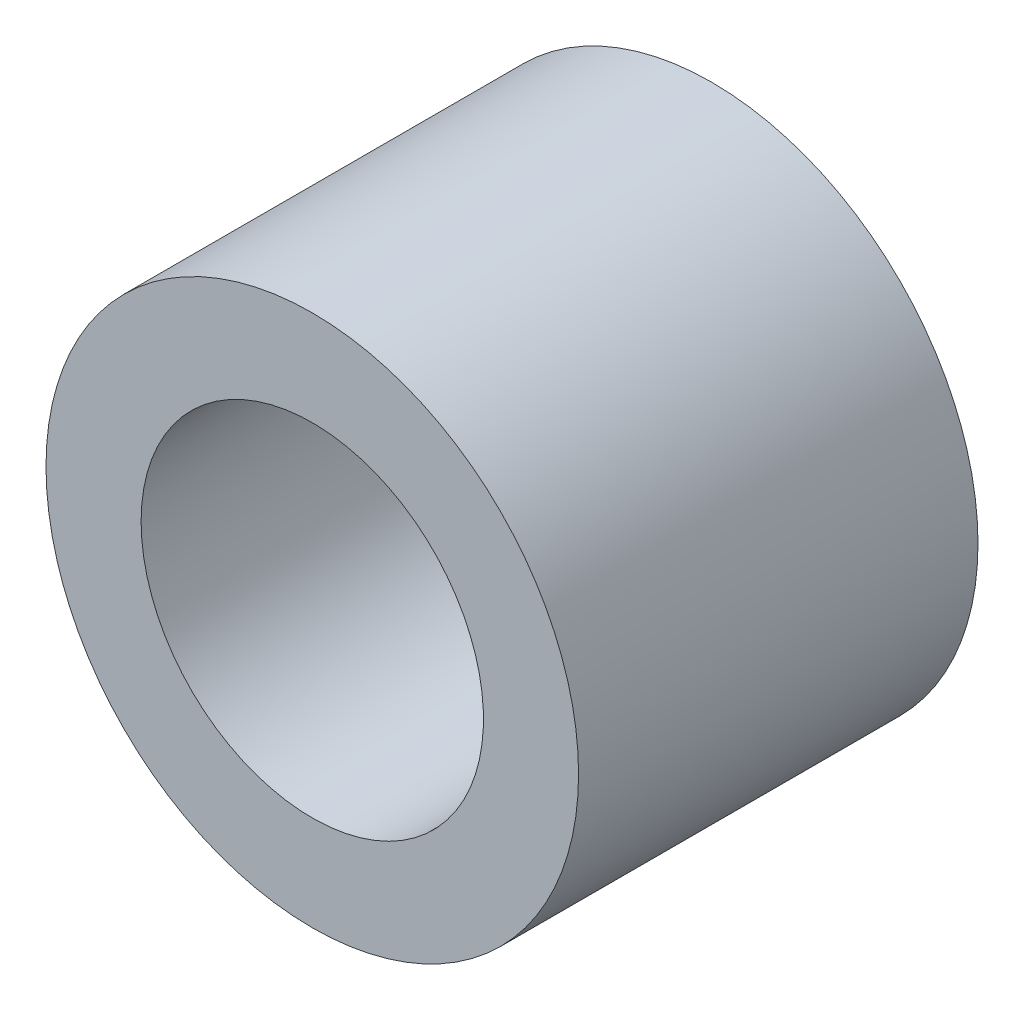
SolidWorks part; units mm, degrees
ref_plane "Front" through (0, 0, 0) normal (0, 0, 1) x (1, 0, 0)
ref_plane "Top" through (0, 0, 0) normal (0, 1, 0) x (1, 0, 0)
ref_plane "Right" through (0, 0, 0) normal (1, 0, 0) x (0, 0, -1)
sketch "Schizzo1" plane through (0, 0, 0) normal (0, 0, 1) x (1, 0, 0)
  circle A0 centre (0, 0) radius 28
  circle A1 centre (0, 0) radius 18
  dimension "D1" = 36
  dimension "D2" = 56
extrude "Estrusione-Estrusione1" add sketch "Schizzo1" along normal mid plane 42
